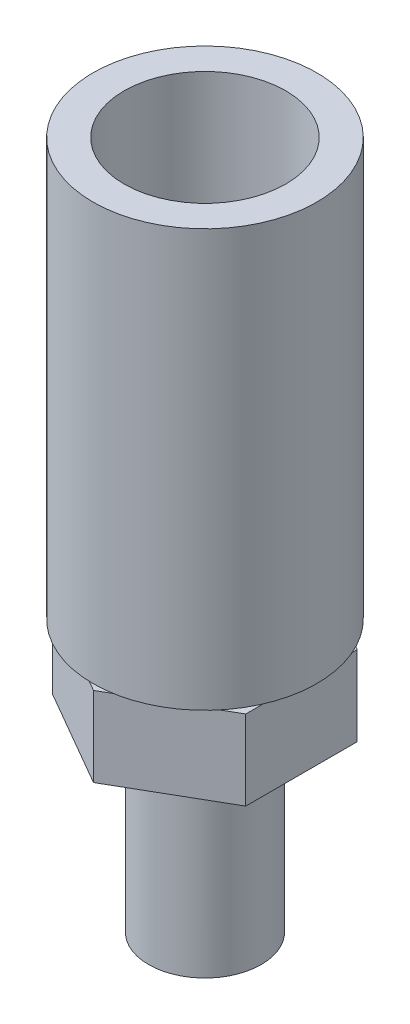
SolidWorks part; units mm, degrees
ref_plane "Front" through (0, 0, 0) normal (0, 0, 1) x (1, 0, 0)
ref_plane "Top" through (0, 0, 0) normal (0, 1, 0) x (1, 0, 0)
ref_plane "Right" through (0, 0, 0) normal (1, 0, 0) x (0, 0, -1)
sketch "Sketch1" plane through (0, 0, 0) normal (0, 1, 0) x (1, 0, 0)
  line L1 (0, 10.9985) -> (-9.525, 5.4993)
  line L2 (-9.525, 5.4993) -> (-9.525, -5.4993)
  line L3 (-9.525, -5.4993) -> (0, -10.9985)
  line L4 (0, -10.9985) -> (9.525, -5.4993)
  line L5 (9.525, -5.4993) -> (9.525, 5.4993)
  line L6 (9.525, 5.4993) -> (0, 10.9985)
  circle A0 centre (0, 0) radius 9.525 construction
  dimension "D1" = 19.05
extrude "Extrude1" add sketch "Sketch1" along normal blind 7.874
sketch "Sketch2" plane through (0, 0, 0) normal (0, 0, 1) x (1, 0, 0)
  line L0 (0, 0) -> (0, -1.8388) construction
  line L1 (8.8011, 7.874) -> (8.8011, 11.6586)
  line L2 (0, 7.874) -> (9.525, 7.874) construction
  line L3 (8.8011, 11.6586) -> (9.398, 11.6586)
  line L4 (9.398, 11.6586) -> (9.398, 13.2334)
  line L5 (9.398, 13.2334) -> (8.8011, 13.2334)
  line L6 (8.8011, 13.2334) -> (8.8011, 14.8844)
  line L7 (8.8011, 14.8844) -> (9.398, 14.8844)
  line L8 (9.398, 14.8844) -> (9.398, 16.4592)
  line L9 (9.398, 16.4592) -> (8.8011, 16.4592)
  line L10 (8.8011, 16.4592) -> (8.8011, 17.272)
  line L11 (8.8011, 17.272) -> (0, 17.272)
  line L12 (0, 17.272) -> (0, 7.874)
  line L13 (-9.398, 11.6586) -> (-9.398, 13.2334) construction
  line L14 (-8.8011, 7.874) -> (-8.8011, 11.6586) construction
  line L15 (8.8011, 7.874) -> (0, 7.874)
  dimension "D1" = 17.6022
  dimension "D2" = 18.796
  dimension "D3" = 1.5748
  dimension "D4" = 1.651
  dimension "D5" = 0.8128
  dimension "D6" = 9.398
revolve "Revolve1" add sketch "Sketch2" angle 360 about L0
sketch "Sketch3" plane through (0, 17.272, 0) normal (0, 1, 0) x (-1, 0, 0)
  circle A0 centre (0, 0) radius 7.875
  dimension "D1" = 15.75
extrude "Extrude2" add sketch "Sketch3" along normal blind 10.41
sketch "Sketch4" plane through (0, 27.682, 0) normal (0, 1, 0) x (-1, 0, 0)
  circle A0 centre (0, -5.08) radius 0.955
  circle A1 centre (0, 0) radius 5.08 construction
  dimension "D1" = 1.91
  dimension "D2" = 10.16
extrude "Extrude8" cut sketch "Sketch4" against normal up to surface (10.41 mm away)
pattern_circular "CirPattern1" count 6 over 360 about axis through (0, 0, 0) along (0, 1, 0) of "Extrude8"
sketch "1" plane through (0.0995, 27.682, 4.4802) normal (0, 1, 0) x (-1, 0, 0)
  circle A0 centre (0.0995, -4.4802) radius 0.955
  dimension "D1" = 1.91
extrude "Extrude9" cut sketch "1" against normal up to surface (10.41 mm away)
sketch "Sketch8" plane through (0, 0, 0) normal (0, -1, 0) x (1, 0, 0)
  circle A0 centre (0, 0) radius 5.5562
  dimension "D1" = 11.1125
extrude "Extrude7" add sketch "Sketch8" along normal blind 18.2803
sketch "Sketch9" plane through (0, 0, 0) normal (0, 0, 1) x (1, 0, 0)
  line L0 (0, 0) -> (0, -1.4263) construction
  circle A0 centre (7.1, 0.2843) radius 0.89
  circle A1 centre (-7.1, 0.2843) radius 0.89 construction
  dimension "D1" = 1.78
  dimension "D2" = 12.42
revolve "o-ring 12.42x1.78" add sketch "Sketch9" angle 360 about L0
sketch "Sketch10" plane through (0, 0, 0) normal (1, 0, 0) x (0, 0, -1)
  line L0 (-11.049, 8.4847) -> (-11.049, 49.6327)
  line L1 (-11.049, 49.6327) -> (-7.9756, 49.6327)
  line L2 (-7.9756, 49.6327) -> (-7.9756, 18.9062)
  line L3 (-7.9756, 18.9062) -> (-10.5689, 18.9062)
  line L4 (-10.5689, 18.9062) -> (-10.5689, 14.7331)
  line L5 (-10.5689, 14.7331) -> (-9.0805, 14.7331)
  line L6 (-9.0805, 14.7331) -> (-9.0805, 13.2091)
  line L7 (-9.0805, 13.2091) -> (-10.5689, 13.2091)
  line L8 (-10.5689, 13.2091) -> (-10.5689, 11.5581)
  line L9 (-10.5689, 11.5581) -> (-9.0805, 11.5581)
  line L10 (-9.0805, 11.5581) -> (-9.0805, 8.4847)
  line L11 (-9.0805, 8.4847) -> (-11.049, 8.4847)
  line L12 (0, 0) -> (0, -7.3458) construction
  line L13 (0, -18.2803) -> (0, 0) construction
  line L14 (0, -4.7979) -> (0, 8.6873) construction
  dimension "D1" = 15.9512
  dimension "D2" = 22.098
  dimension "D3" = 18.161
  dimension "D4" = 1.524
  dimension "D5" = 1.651
  dimension "D6" = 3.0734
  dimension "D7" = 41.148
revolve "Locking Sleeve" add sketch "Sketch10" angle 360 about L12
